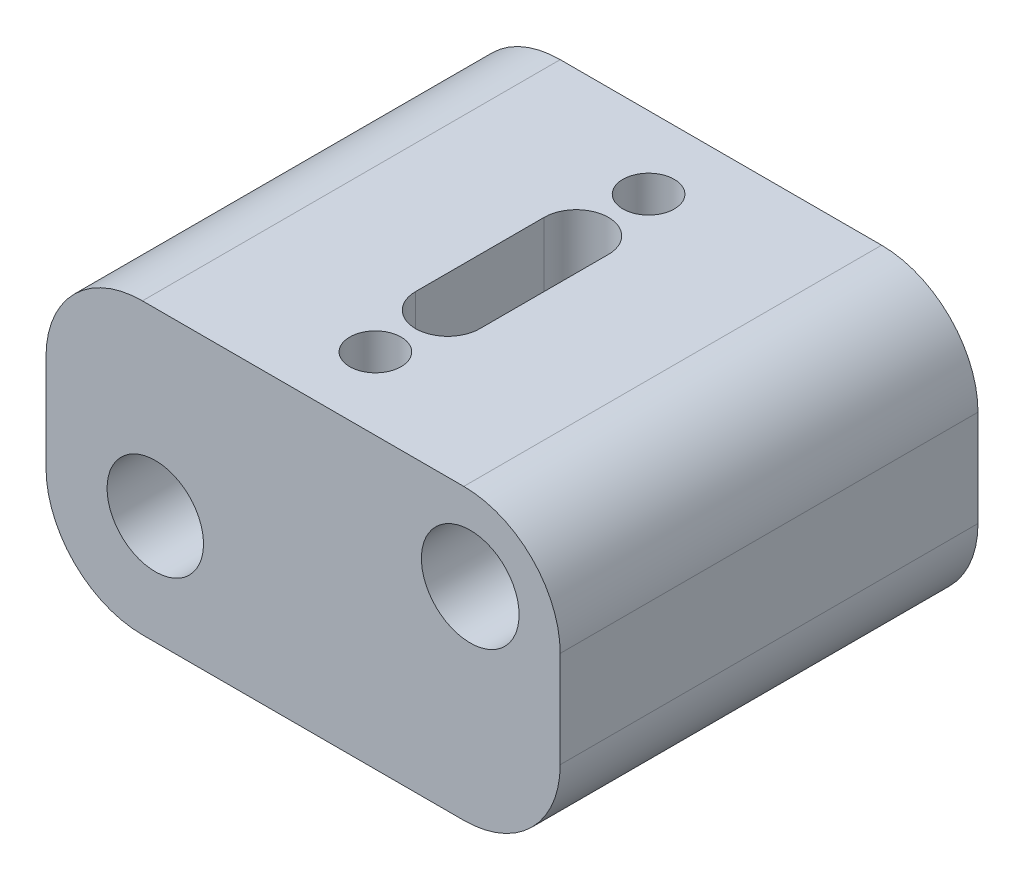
SolidWorks part; units mm, degrees
ref_plane "Plan de face" through (0, 0, 0) normal (0, 0, 1) x (1, 0, 0)
ref_plane "Plan de dessus" through (0, 0, 0) normal (0, 1, 0) x (1, 0, 0)
ref_plane "Plan de droite" through (0, 0, 0) normal (1, 0, 0) x (0, 0, -1)
sketch "Esquisse1" plane through (0, 0, 0) normal (0, 0, 1) x (1, 0, 0)
  line L1 (-79.3113, 44.7508) -> (0.6887, 44.7508)
  line L2 (-79.3113, 44.7508) -> (-79.3113, -0.2492)
  line L3 (-79.3113, -0.2492) -> (0.6887, -0.2492)
  line L4 (0.6887, 44.7508) -> (0.6887, -0.2492)
  dimension "D1" = 80
  dimension "D2" = 45
extrude "Boss.-Extru.1" add sketch "Esquisse1" along normal blind 65
sketch "Esquisse4" plane through (0, 0, 0) normal (0, 0, -1) x (-1, 0, 0)
  line L0 (79.3113, 44.7508) -> (79.3113, -0.2492) construction
  line L1 (79.3113, -0.2492) -> (-0.6887, -0.2492) construction
  circle A0 centre (62.3113, 16.7508) radius 12.8
  dimension "D1" = 25.6
  dimension "D2" = 17
  dimension "D3" = 17
extrude "Enlèv. mat.-Extru.2" cut sketch "Esquisse4" against normal blind 26
sketch "Esquisse6" plane through (0, 0, 0) normal (0, 0, -1) x (-1, 0, 0)
  line L0 (-0.6887, -0.2492) -> (-0.6887, 44.7508) construction
  circle A0 centre (13.3113, 31.7508) radius 5.5
  circle A1 centre (62.3113, 16.7508) radius 12.8 construction
  dimension "D1" = 11
  dimension "D2" = 15
  dimension "D3" = 14
extrude "Enlèv. mat.-Extru.3" cut sketch "Esquisse6" against normal through all
sketch "Esquisse10" plane through (0, 0, 0) normal (0, 0, -1) x (-1, 0, 0)
  line L0 (79.3113, 44.7508) -> (79.3113, -0.2492) construction
  line L1 (79.3113, -0.2492) -> (-0.6887, -0.2492) construction
  circle A0 centre (62.3113, 16.7508) radius 7.5
  dimension "D2" = 17
  dimension "D3" = 15
  dimension "D1" = 17
extrude "Enlèv. mat.-Extru.4" cut sketch "Esquisse10" against normal through all
fillet "Congé1" radius 10 1 edges at (-69.8113, 16.7508, 26)
sketch "Esquisse11" plane through (0, 0, 65) normal (0, 0, 1) x (1, 0, 0)
  line L0 (0.6887, -0.2492) -> (0.6887, 44.7508) construction
  line L1 (0.6887, 44.7508) -> (-79.3113, 44.7508) construction
  circle A0 centre (-13.3113, 31.7508) radius 7.6
  dimension "D1" = 15.2
  dimension "D2" = 14
  dimension "D3" = 13
extrude "Enlèv. mat.-Extru.5" cut sketch "Esquisse11" against normal blind 30
sketch "Esquisse12" plane through (0, -0.2492, 0) normal (0, -1, 0) x (1, 0, 0)
  line L0 (-79.3113, 65) -> (0.6887, 65) construction
  line L1 (0.6887, 65) -> (0.6887, 0) construction
  circle A0 centre (-39.3113, 53.75) radius 4
  dimension "D1" = 8
  dimension "D2" = 11.25
  dimension "D3" = 40
sketch "Esquisse13" plane through (0, -0.2492, 0) normal (0, -1, 0) x (1, 0, 0)
  line L0 (-79.3113, 0) -> (0.6887, 0) construction
  line L1 (0.6887, 65) -> (0.6887, 0) construction
  circle A0 centre (-39.3113, 11.25) radius 4
  dimension "D1" = 8
  dimension "D2" = 11.25
  dimension "D3" = 40
extrude "Enlèv. mat.-Extru.6" cut sketch "Esquisse12" against normal through all
extrude "Enlèv. mat.-Extru.7" cut sketch "Esquisse13" against normal through all
fillet "Congé2" radius 15 1 edges at (0.6887, -0.2492, 32.5)
fillet "Congé3" radius 15 1 edges at (0.6887, 44.7508, 32.5)
fillet "Congé4" radius 15 1 edges at (-79.3113, 44.7508, 32.5)
fillet "Congé5" radius 15 1 edges at (-79.3113, -0.2492, 32.5)
sketch "Esquisse16" plane through (0, 44.7508, 0) normal (0, 1, 0) x (1, 0, 0)
  line L0 (-39.3113, -42.5) -> (-39.3113, -22.5) construction
  line L1 (-44.3113, -42.5) -> (-44.3113, -22.5)
  line L2 (-34.3113, -42.5) -> (-34.3113, -22.5)
  arc A0 (-44.3113, -42.5) -> (-34.3113, -42.5) centre (-39.3113, -42.5) ccw
  arc A1 (-34.3113, -22.5) -> (-44.3113, -22.5) centre (-39.3113, -22.5) ccw
  circle A2 centre (-39.3113, -53.75) radius 4 construction
  circle A3 centre (-39.3113, -11.25) radius 4 construction
  point P2 (-39.3113, -32.5)
  dimension "D2" = 20
  dimension "D4" = 11.25
  dimension "D5" = 11.25
  dimension "D1" = 10
  dimension "D3" = 0
extrude "Enlèv. mat.-Extru.8" cut sketch "Esquisse16" against normal through all
